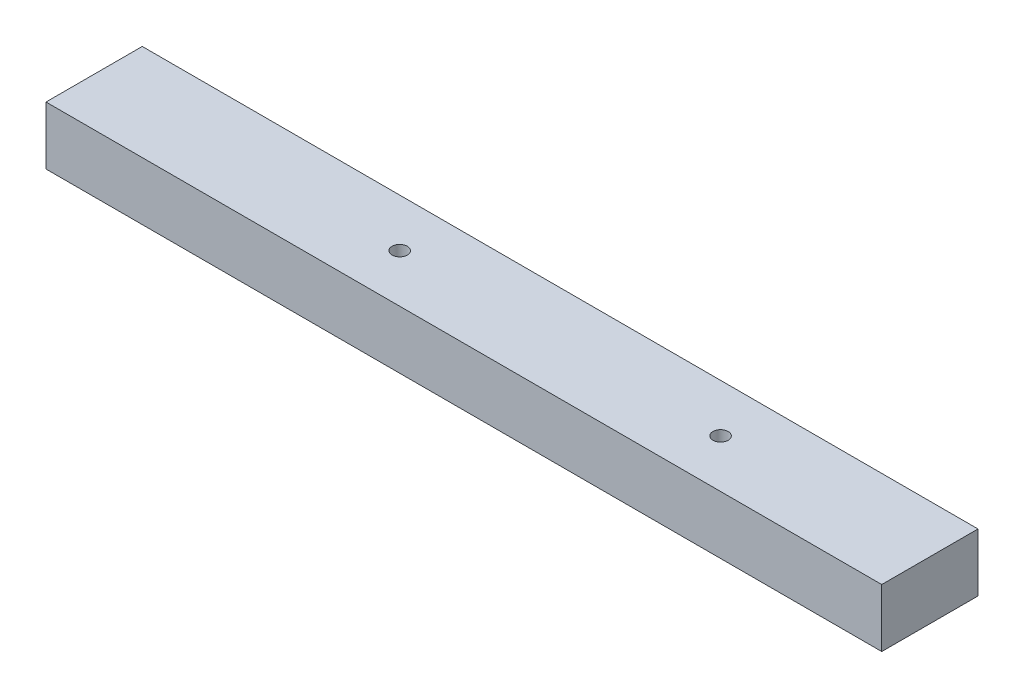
SolidWorks part; units mm, degrees
ref_plane "Front Plane" through (0, 0, 0) normal (0, 0, 1) x (1, 0, 0)
ref_plane "Top Plane" through (0, 0, 0) normal (0, 1, 0) x (1, 0, 0)
ref_plane "Right Plane" through (0, 0, 0) normal (1, 0, 0) x (0, 0, -1)
sketch "Sketch1" plane through (0, 0, 0) normal (0, 1, 0) x (1, 0, 0)
  line L1 (0, 0) -> (1220, 0)
  line L2 (0, 0) -> (0, 63)
  line L3 (0, 63) -> (1220, 63)
  line L4 (1220, 0) -> (1220, 63)
  dimension "D1" = 1220
  dimension "D2" = 63
extrude "Boss-Extrude1" add sketch "Sketch1" along normal blind 38
sketch "Sketch2" plane through (0, 38, 0) normal (0, 1, 0) x (1, 0, 0)
  line L0 (0, 31.5) -> (1220, 31.5) construction
  line L1 (0, 63) -> (0, 0) construction
  line L2 (1220, 0) -> (1220, 63) construction
  line L3 (200, 31.5) -> (410, 31.5) construction
  line L4 (610, 63) -> (610, 0) construction
  line L5 (1220, 63) -> (0, 63) construction
  line L6 (0, 0) -> (1220, 0) construction
  circle A0 centre (200, 31.5) radius 5
  circle A2 centre (410, 31.5) radius 5
  circle A3 centre (810, 31.5) radius 5
  circle A4 centre (1020, 31.5) radius 5
extrude "Cut-Extrude1" cut sketch "Sketch2" against normal blind 38
sketch "Sketch3" plane through (0, 38, 0) normal (0, 1, 0) x (1, 0, 0)
  line L0 (1220, 63) -> (0, 63) construction
  line L1 (0, 0) -> (610, 0)
  line L2 (0, 0) -> (0, 63)
  line L3 (0, 63) -> (610, 63)
  line L4 (610, 0) -> (610, 63)
  line L5 (1220, 0) -> (1220, 63) construction
  line L7 (1220, 0) -> (1157, 0)
  line L8 (1220, 0) -> (1220, 63)
  line L9 (1220, 63) -> (1157, 63)
  line L10 (1157, 0) -> (1157, 63)
  dimension "D1" = 610
  dimension "D2" = 63
extrude "Cut-Extrude2" cut sketch "Sketch3" against normal up to next
equation "\"Hole Diameter\"= 10"
equation "\"D1@Sketch2\"=\"Hole Diameter\""
